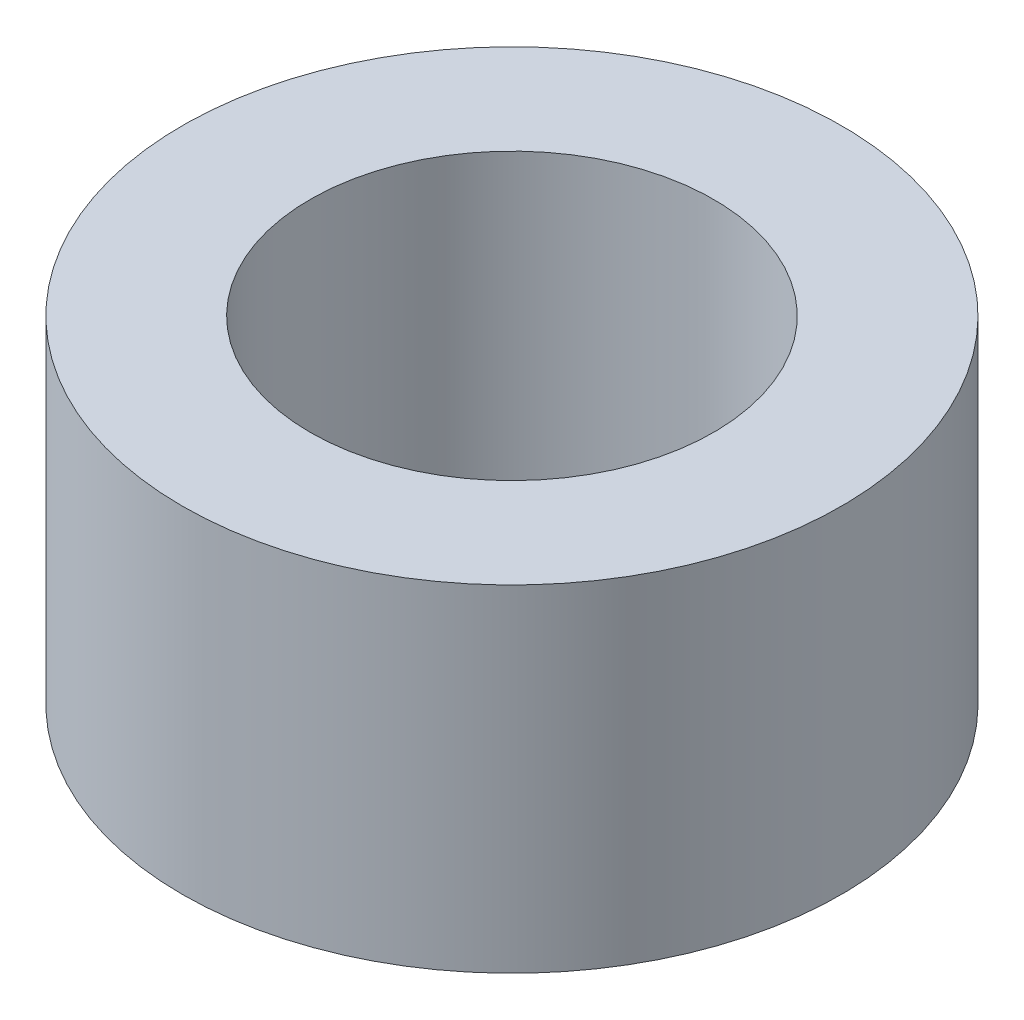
SolidWorks part; units mm, degrees
ref_plane "Front" through (0, 0, 0) normal (0, 0, 1) x (1, 0, 0)
ref_plane "Top" through (0, 0, 0) normal (0, 1, 0) x (1, 0, 0)
ref_plane "Right" through (0, 0, 0) normal (1, 0, 0) x (0, 0, -1)
sketch "Sketch1" plane through (0, 0, 0) normal (0, 1, 0) x (1, 0, 0)
  circle A0 centre (0, 0) radius 12.446
  circle A1 centre (0, 0) radius 7.62
  dimension "D1" = 24.892
  dimension "D2" = 15.24
extrude "Base-Extrude" add sketch "Sketch1" along normal blind 12.7
